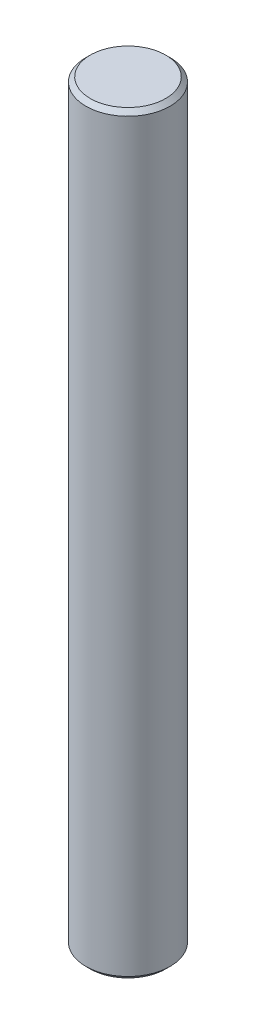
SolidWorks part; units mm, degrees
ref_plane "Front/Back" through (0, 0, 0) normal (0, 0, 1) x (1, 0, 0)
ref_plane "Top/Bottom" through (0, 0, 0) normal (0, 1, 0) x (1, 0, 0)
ref_plane "Right/Left" through (0, 0, 0) normal (1, 0, 0) x (0, 0, -1)
sketch "Sketch1" plane through (0, 0, 0) normal (0, 1, 0) x (1, 0, 0)
  circle A0 centre (0, 0) radius 2.413
  dimension "D1" = 4.826
extrude "Extrude1" add sketch "Sketch1" along normal mid plane 43.18
chamfer "Chamfer1" distance 0.254 angle 45 2 edges at (0, -21.59, 2.413) (0, 21.59, 2.413)
